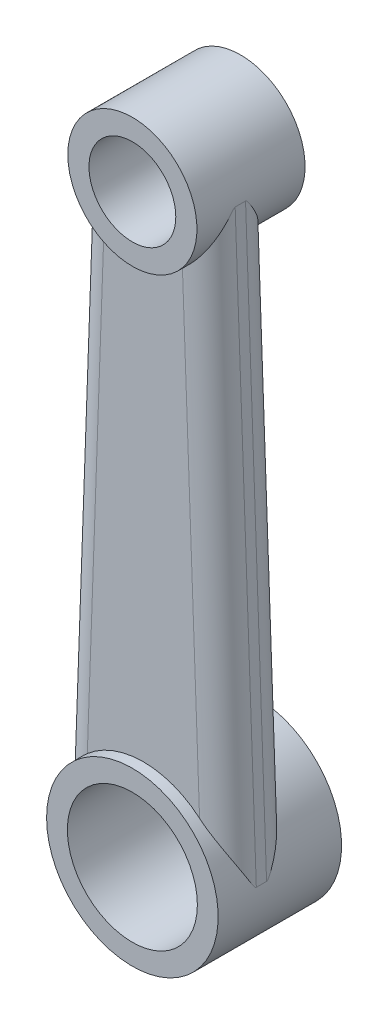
SolidWorks part; units mm, degrees
ref_plane "Front Plane" through (0, 0, 0) normal (0, 0, 1) x (1, 0, 0)
ref_plane "Top Plane" through (0, 0, 0) normal (0, 1, 0) x (1, 0, 0)
ref_plane "Right Plane" through (0, 0, 0) normal (1, 0, 0) x (0, 0, -1)
ref_plane "Plane4" through (0, 0, 0) normal (0, 1, 0) x (1, 0, 0)
sketch "CRO1" plane through (0, 0, 0) normal (0, 1, 0) x (1, 0, 0)
  line L0 (-8.382, 3.1665) -> (8.382, 3.1665)
  line L1 (8.382, 3.1665) -> (8.382, -3.1665)
  line L2 (8.382, -3.1665) -> (-8.382, -3.1665)
  line L3 (-8.382, -3.1665) -> (-8.382, 3.1665)
  dimension "D1" = 6.3331
  dimension "D2" = 16.764
ref_plane "Plane5" through (0, 57.15, 0) normal (0, 1, 0) x (1, 0, 0)
sketch "Sketch2" plane through (0, 57.15, 0) normal (0, 1, 0) x (1, 0, 0)
  line L0 (-6.3077, 3.1665) -> (6.3077, 3.1665)
  line L1 (6.3077, 3.1665) -> (6.3077, -3.1835)
  line L2 (6.3077, -3.1835) -> (-6.3077, -3.1835)
  line L3 (-6.3077, -3.1835) -> (-6.3077, 3.1665)
  dimension "D1" = 6.35
  dimension "D2" = 12.6153
loft "Loft1" add profiles "Sketch2", "CRO1"
ref_plane "Plane6" through (0, 0, 0) normal (0, 0, 1) x (0, 1, 0)
sketch "S2D0001" plane through (0, 0, 0) normal (0, 0, 1) x (0, 1, 0)
  circle A0 centre (0, 0) radius 6.35
  circle A1 centre (57.15, 0) radius 6.1857
  dimension "D1" = 12.3715
  dimension "D2" = 12.7
extrude "Extrude1" add sketch "S2D0001" along normal blind 4.2503
ref_plane "Plane7" through (0, 0, 4.2503) normal (0, 0, -1) x (0, -1, 0)
sketch "Sketch4" plane through (0, 0, 4.2503) normal (0, 0, -1) x (0, -1, 0)
  circle A0 centre (-57.15, 0) radius 6.3077
  dimension "D1" = 12.6153
extrude "Extrude2" add sketch "Sketch4" along normal blind 10.5664
ref_plane "Plane8" through (0, 0, 4.2503) normal (0, 0, -1) x (0, -1, 0)
sketch "HEAD4" plane through (0, 0, 4.2503) normal (0, 0, -1) x (0, -1, 0)
  circle A0 centre (0, 0) radius 8.382
  dimension "D1" = 16.764
extrude "Extrude3" add sketch "HEAD4" along normal blind 12.0566
fillet "Fillet1" radius 2.6667 4 edges
sketch "Sketch7" plane through (0, 0, 4.2503) normal (0, 0, 1) x (1, 0, 0)
  circle A0 centre (0, 57.15) radius 4.2418
  circle A1 centre (0, 57.15) radius 6.3077 construction
  point P2 (0, 0)
  dimension "D1" = 8.4836
extrude "Cut-Extrude1" cut sketch "Sketch7" against normal through all
sketch "Sketch8" plane through (0, 0, 4.2503) normal (0, 0, 1) x (1, 0, 0)
  circle A0 centre (0, 0) radius 6.35
  dimension "D1" = 12.7
extrude "Cut-Extrude2" cut sketch "Sketch8" against normal through all
